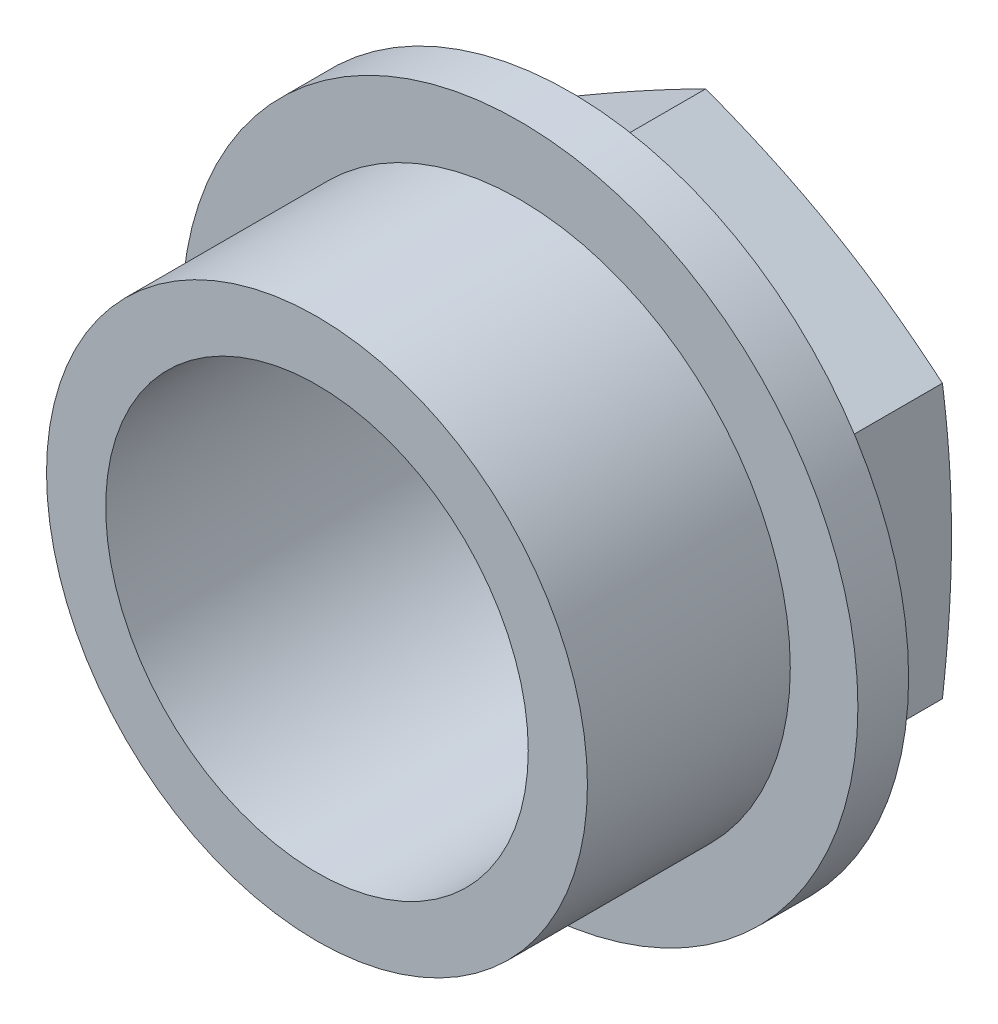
SolidWorks part; units mm, degrees
ref_plane "正面" through (0, 0, 0) normal (0, 0, 1) x (1, 0, 0)
ref_plane "平面" through (0, 0, 0) normal (0, 1, 0) x (1, 0, 0)
ref_plane "右側面" through (0, 0, 0) normal (1, 0, 0) x (0, 0, -1)
sketch "ｽｹｯﾁ2" plane through (0, 0, 0) normal (0, 0, 1) x (1, 0, 0)
  circle A0 centre (0, 0) radius 10
  dimension "D1" = 20
extrude "ﾎﾞｽ - 押し出し1" add sketch "ｽｹｯﾁ2" along normal blind 1.5
sketch "ｽｹｯﾁ3" plane through (0, 0, 1.5) normal (0, 0, 1) x (1, 0, 0)
  circle A0 centre (0, 0) radius 8
  dimension "D1" = 16
extrude "ﾎﾞｽ - 押し出し2" add sketch "ｽｹｯﾁ3" along normal blind 6
sketch "ｽｹｯﾁ4" plane through (0, 0, 0) normal (0, 0, -1) x (-1, 0, 0)
  line L1 (0, 8.0829) -> (-7, 4.0415)
  line L2 (-7, 4.0415) -> (-7, -4.0415)
  line L3 (-7, -4.0415) -> (0, -8.0829)
  line L4 (0, -8.0829) -> (7, -4.0415)
  line L5 (7, -4.0415) -> (7, 4.0415)
  line L6 (7, 4.0415) -> (0, 8.0829)
  circle A0 centre (0, 0) radius 7 construction
  point P1 (0, 0)
  dimension "D1" = 14
extrude "ﾎﾞｽ - 押し出し3" add sketch "ｽｹｯﾁ4" along normal blind 6
sketch "ｽｹｯﾁ6" plane through (0, 0, 0) normal (1, 0, 0) x (0, 0, -1)
  line L0 (6, 8.0829) -> (0, 8.0829) construction
  line L3 (6, 0) -> (4.1, 0) construction
  line L5 (6, 8.0829) -> (6, 0.01)
  line L10 (6, 8.0829) -> (4, 8.0829)
  line L11 (6, 0.01) -> (4, 8.0829)
  line L12 (6, 8.0829) -> (6, 4.0415) construction
  point P2 (6.0945, 0.0538)
  dimension "D2" = 0.01
  dimension "D1" = 2
revolve "ｶｯﾄ - 回転6" cut sketch "ｽｹｯﾁ6" angle 360 about L3
hole_wizard "Ø12.5 (12.5) 直径の穴1" positions "ｽｹｯﾁ7" profile "ｽｹｯﾁ8" hole size "Ø12.5" standard "JIS"
sketch "ｽｹｯﾁ7" plane through (0, 0, 7.5) normal (0, 0, 1) x (1, 0, 0)
  point P0 (0, 0)
sketch "ｽｹｯﾁ8" plane through (0, 0, 7.5) normal (1, 0, 0) x (0, -1, 0)
  line L0 (0, 0) -> (0, 12.7554)
  line L1 (0, 12.7554) -> (6.25, 9)
  line L2 (6.25, 9) -> (6.25, 0)
  line L5 (6.25, 0) -> (0, 0)
  line L10 (0, 12.7554) -> (-6.25, 9) construction
  line L11 (0, -6.35) -> (0, 107.95) construction
  dimension "穴の直径" = 12.5
  dimension "穴の深さ" = 9
  dimension "ﾄﾞﾘﾙ角度" = 118
